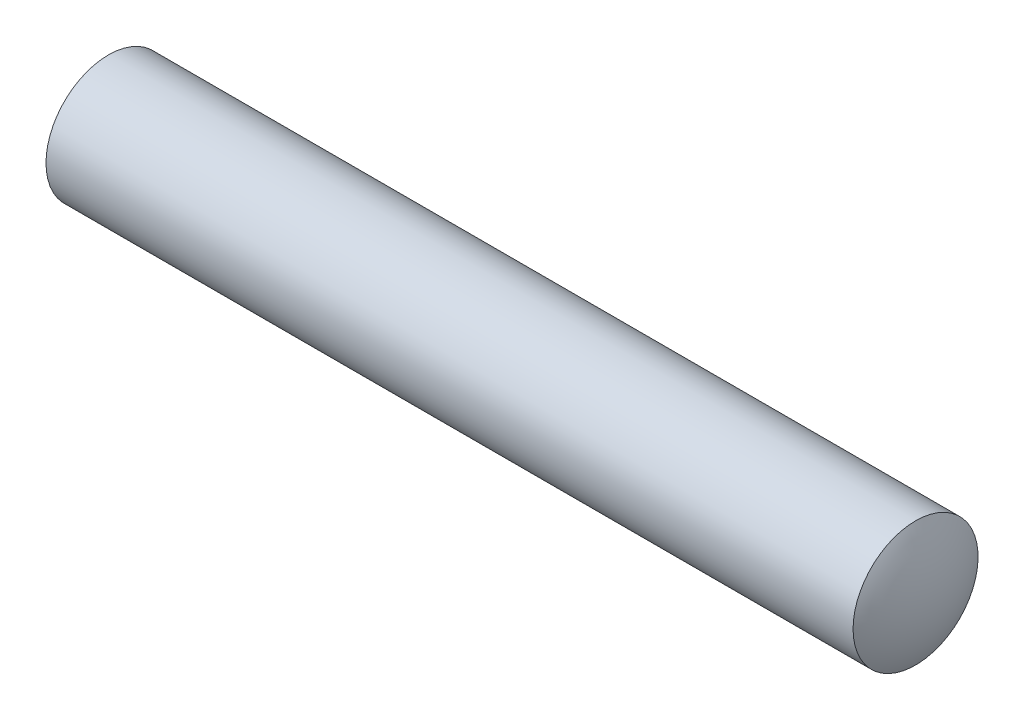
SolidWorks part; units mm, degrees
ref_plane "Plan1" through (0, 0, 0) normal (0, 0, 1) x (1, 0, 0)
ref_plane "Plan2" through (0, 0, 0) normal (0, 1, 0) x (1, 0, 0)
ref_plane "Plan3" through (0, 0, 0) normal (1, 0, 0) x (0, 0, -1)
sketch "Esquisse2" plane through (0, 0, 0) normal (0, 0, 1) x (1, 0, 0)
  line L0 (0, 0) -> (40, 0)
  line L1 (0.7895, 2.975) -> (39.2105, 2.975)
  line L2 (18, 0) -> (44, 0) construction
  arc A0 (0.7895, 2.975) -> (0, 0) centre (6, 0) ccw
  arc A1 (40, 0) -> (39.2105, 2.975) centre (34, 0) ccw
  dimension "D1" = 12
  dimension "D2" = 12
  dimension "D3" = 28
  dimension "D4" = 2.975
revolve "Base-Révolution" add sketch "Esquisse2" angle 360 about L2
